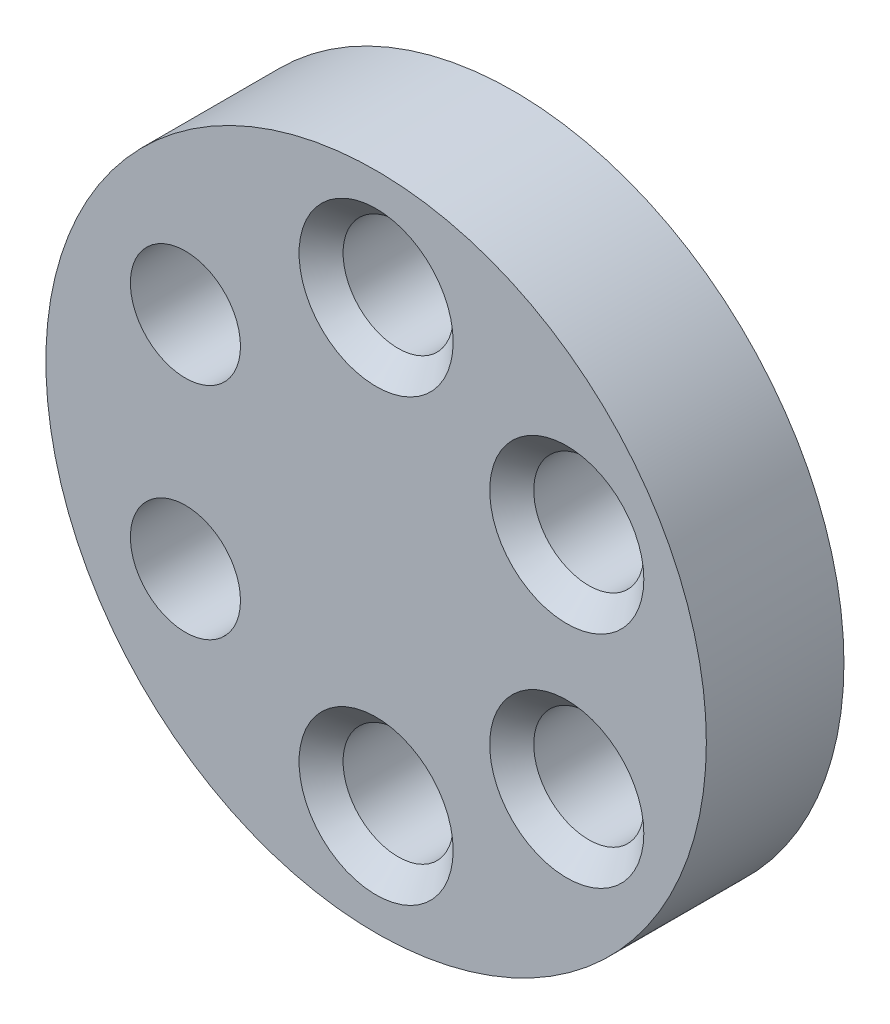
SolidWorks part; units mm, degrees
ref_plane "Płaszczyzna przednia" through (0, 0, 0) normal (0, 0, 1) x (1, 0, 0)
ref_plane "Płaszczyzna górna" through (0, 0, 0) normal (0, 1, 0) x (1, 0, 0)
ref_plane "Płaszczyzna prawa" through (0, 0, 0) normal (1, 0, 0) x (0, 0, -1)
sketch "Szkic1" plane through (0, 0, 0) normal (0, 0, 1) x (1, 0, 0)
  circle A0 centre (0, 0) radius 60
  circle A1 centre (0, 0) radius 40 construction
  circle A2 centre (0, 40) radius 10
  circle A3 centre (34.641, 20) radius 10
  circle A4 centre (34.641, -20) radius 10
  circle A5 centre (0, -40) radius 10
  circle A6 centre (-34.641, -20) radius 10
  circle A7 centre (-34.641, 20) radius 10
  point P15 (0, 0)
  dimension "D1" = 120
  dimension "D2" = 80
  dimension "D3" = 20
  dimension "D4" = 6
extrude "Dodanie-wyciągnięcie1" add sketch "Szkic1" along normal blind 25
chamfer "Sfazowanie1" distance 4 angle 45 8 edges at (44.641, -20, 0) (44.641, -20, 25) (44.641, 20, 0) (44.641, 20, 25) (10, 40, 0) (10, 40, 25) (10, -40, 0) (10, -40, 25)
